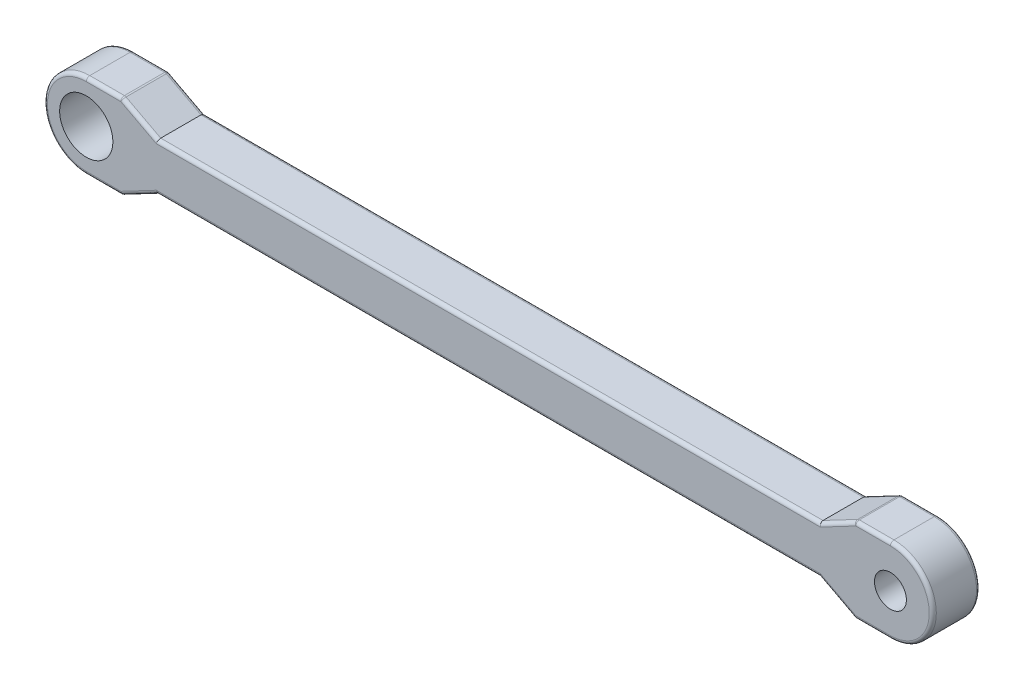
SolidWorks part; units mm, degrees
ref_plane "Front Plane" through (0, 0, 0) normal (0, 0, 1) x (1, 0, 0)
ref_plane "Top Plane" through (0, 0, 0) normal (0, 1, 0) x (1, 0, 0)
ref_plane "Right Plane" through (0, 0, 0) normal (1, 0, 0) x (0, 0, -1)
sketch "Sketch1" plane through (0, 0, 0) normal (0, 0, 1) x (1, 0, 0)
  line L0 (-43.18, 0) -> (43.18, 0) construction
  line L1 (-43.18, 4.548) -> (43.18, 4.548)
  line L2 (-43.18, -4.548) -> (43.18, -4.548)
  line L3 (-43.18, 3.048) -> (-43.18, 4.548) construction
  arc A0 (-43.18, 4.548) -> (-43.18, -4.548) centre (-43.18, 0) ccw
  arc A1 (43.18, -4.548) -> (43.18, 4.548) centre (43.18, 0) ccw
  circle A2 centre (-43.18, 0) radius 3.048
  circle A3 centre (43.18, 0) radius 3.048
  point P3 (0, 0)
  dimension "D3" = 6.096
  dimension "D1" = 86.36
  dimension "D2" = 1.5
extrude "Boss-Extrude1" add sketch "Sketch1" along normal blind 5.08
sketch "Sketch2" plane through (0, 0, 0) normal (0, 0, 1) x (1, 0, 0)
  line L0 (-39.37, 4.548) -> (-35.56, 2.54)
  line L1 (43.18, 4.548) -> (-43.18, 4.548) construction
  line L2 (-35.56, 2.54) -> (35.56, 2.54)
  line L3 (35.56, 2.54) -> (39.37, 4.548)
  line L4 (39.37, 4.548) -> (-39.37, 4.548)
  line L5 (-35.56, -2.54) -> (35.56, -2.54)
  line L6 (35.56, -2.54) -> (39.37, -4.548)
  line L7 (-43.18, -4.548) -> (43.18, -4.548) construction
  line L8 (39.37, -4.548) -> (-39.37, -4.548)
  line L9 (-39.37, -4.548) -> (-35.56, -2.54)
  dimension "D1" = 3.81
  dimension "D2" = 7.62
  dimension "D3" = 3.81
  dimension "D4" = 5.08
extrude "Cut-Extrude1" cut sketch "Sketch2" along normal through all
fillet "Fillet1" radius 0.381 28 edges at (-47.728, 0, 5.08) (-41.275, 4.548, 5.08) (-37.465, 3.544, 5.08) (0, 2.54, 5.08) (37.465, 3.544, 5.08) (41.275, 4.548, 5.08) (47.728, 0, 5.08) (41.275, -4.548, 5.08) (37.465, -3.544, 5.08) (0, -2.54, 5.08) (-37.465, -3.544, 5.08) (-41.275, -4.548, 5.08) (0, -2.54, 0) (37.465, -3.544, 0) (41.275, -4.548, 0) (47.728, 0, 0) (41.275, 4.548, 0) (37.465, 3.544, 0) (0, 2.54, 0) (-37.465, 3.544, 0) (-41.275, 4.548, 0) (-47.728, 0, 0) (-41.275, -4.548, 0) (-37.465, -3.544, 0) (-39.37, -4.548, 2.54) (39.37, -4.548, 2.54) (39.37, 4.548, 2.54) (-39.37, 4.548, 2.54)
sketch "Sketch3" plane through (0, 0, 5.08) normal (0, 0, 1) x (1, 0, 0)
  circle A0 centre (-43.18, 0) radius 3.048
  circle A1 centre (-43.18, 0) radius 3.048 construction
extrude "Boss-Extrude2" add sketch "Sketch3" against normal up to surface (5.08 mm away)
mirror "Mirror1" about plane through (0, 0, 0) normal (1, 0, 0) of "Boss-Extrude2"
sketch "Sketch4" plane through (0, 0, 5.08) normal (0, 0, 1) x (1, 0, 0)
  circle A0 centre (-43.18, 0) radius 1.7145
  point P2 (-43.18, 0)
  dimension "D1" = 3.429
extrude "Cut-Extrude2" cut sketch "Sketch4" against normal through all
mirror "Mirror2" about plane through (0, 0, 0) normal (1, 0, 0) of "Cut-Extrude2"
sketch "Sketch5" plane through (0, 0, 5.08) normal (0, 0, 1) x (1, 0, 0)
  circle A0 centre (-43.18, 0) radius 2.8575
  dimension "D1" = 5.715
extrude "Cut-Extrude3" cut sketch "Sketch5" against normal through all
